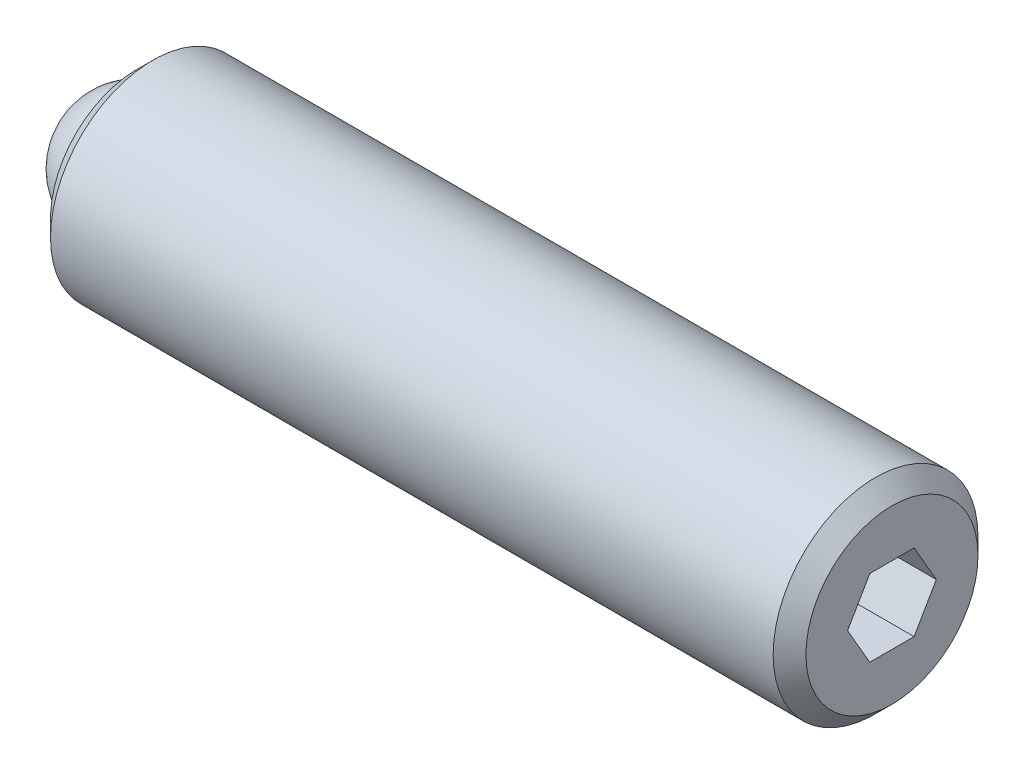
SolidWorks part; units mm, degrees
ref_plane "Front Plane" through (0, 0, 0) normal (0, 0, 1) x (1, 0, 0)
ref_plane "Top Plane" through (0, 0, 0) normal (0, 1, 0) x (1, 0, 0)
ref_plane "Right Plane" through (0, 0, 0) normal (1, 0, 0) x (0, 0, -1)
sketch "Sketch2" plane through (0, 0, 0) normal (1, 0, 0) x (0, 0, -1)
  circle A0 centre (0, 0) radius 3.175
  dimension "D1" = 6.35
extrude "Boss-Extrude1" add sketch "Sketch2" along normal blind 23.4156
sketch "Sketch3" plane through (0, 0, 0) normal (-1, 0, 0) x (0, 0, 1)
  circle A0 centre (0, 0) radius 1.9812
  dimension "D1" = 3.9624
chamfer "Chamfer1" distance 0.508 angle 45 1 edges at (0, 0, -3.175)
chamfer "Chamfer2" distance 0.508 angle 45 1 edges at (23.4156, 0, -3.175)
sketch "Sketch4" plane through (23.4156, 0, 0) normal (1, 0, 0) x (0, 0, -1)
  line L1 (1.3748, 0) -> (0.6874, 1.1906)
  line L2 (0.6874, 1.1906) -> (-0.6874, 1.1906)
  line L3 (-0.6874, 1.1906) -> (-1.3748, 0)
  line L4 (-1.3748, 0) -> (-0.6874, -1.1906)
  line L5 (-0.6874, -1.1906) -> (0.6874, -1.1906)
  line L6 (0.6874, -1.1906) -> (1.3748, 0)
  circle A0 centre (0, 0) radius 1.1906 construction
  dimension "D1" = 2.3813
extrude "Cut-Extrude2" cut sketch "Sketch4" against normal blind 2.286
extrude "Cut-Extrude3" cut sketch "Sketch3" against normal blind 1.9844
sketch "Sketch5" plane through (0, 0, 0) normal (-1, 0, 0) x (0, 0, 1)
  line L0 (0, 0) -> (0, -1.9844)
  line L1 (0, 0) -> (0, 1.9844)
  arc A0 (0, 1.9844) -> (0, -1.9844) centre (0, 0) ccw
  dimension "D1" = 1.9844
revolve "Revolve1" add sketch "Sketch5" angle 360 about L1
